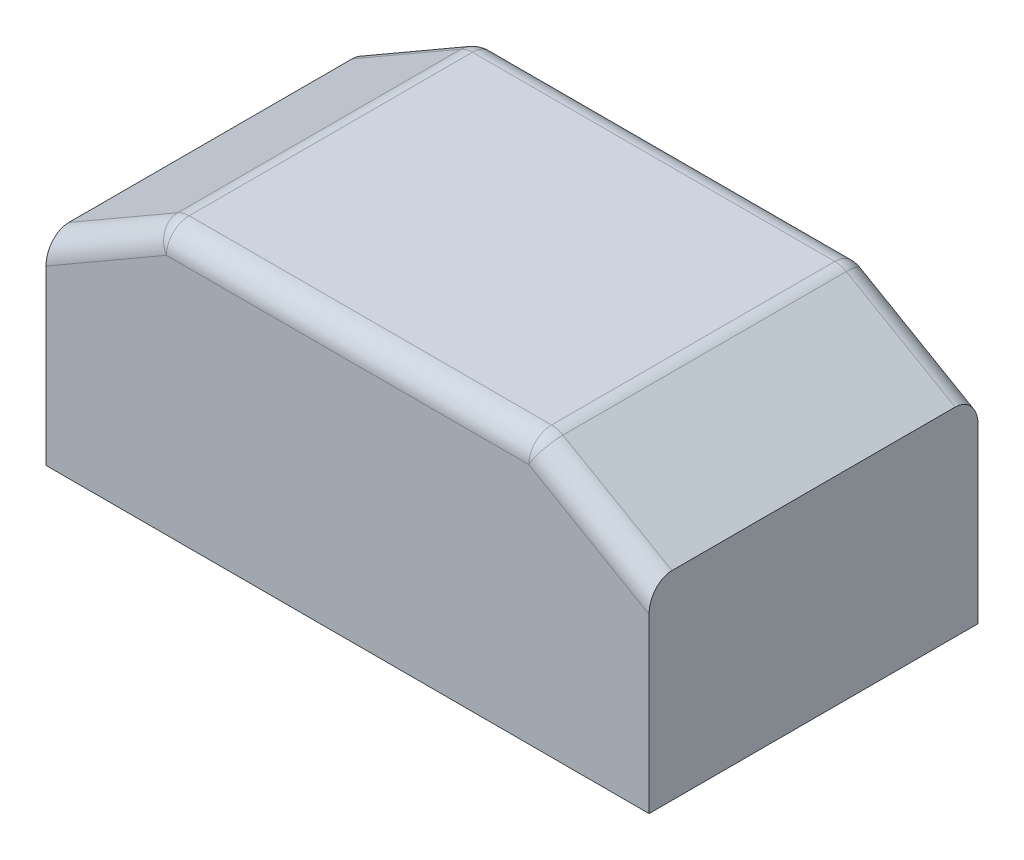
SolidWorks part; units mm, degrees
ref_plane "Alzado" through (0, 0, 0) normal (0, 0, 1) x (1, 0, 0)
ref_plane "Planta" through (0, 0, 0) normal (0, 1, 0) x (1, 0, 0)
ref_plane "Vista lateral" through (0, 0, 0) normal (1, 0, 0) x (0, 0, -1)
sketch "Croquis1" plane through (0, 0, 0) normal (0, 1, 0) x (1, 0, 0)
  line L1 (0, 0) -> (132, 0)
  line L2 (0, 0) -> (0, 72)
  line L3 (0, 72) -> (132, 72)
  line L4 (132, 0) -> (132, 72)
  dimension "D1" = 132
  dimension "D2" = 72
extrude "Saliente-Extruir1" add sketch "Croquis1" along normal blind 58
chamfer "Chaflán1" distance 25 angle 30 2 edges at (0, 58, -36) (132, 58, -36)
fillet "Redondeo1" radius 5 8 edges at (119.5, 50.7831, -72) (12.5, 50.7831, -72) (66, 58, -72) (119.5, 50.7831, 0) (12.5, 50.7831, 0) (66, 58, 0) (107, 58, -36) (25, 58, -36)
